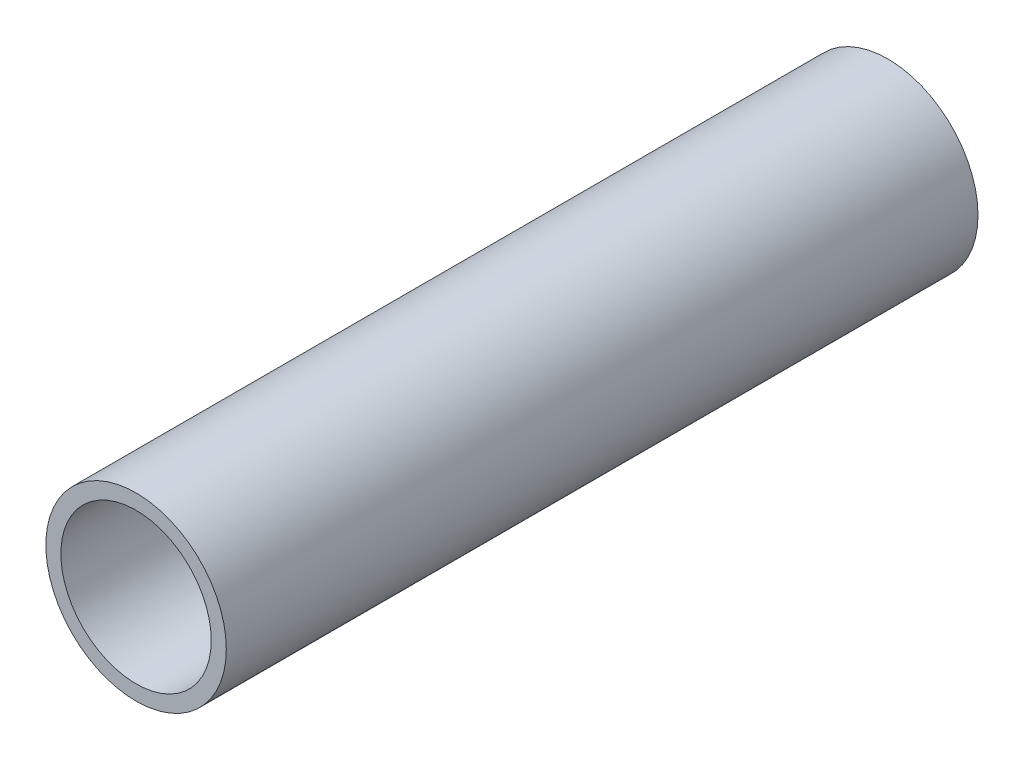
SolidWorks part; units mm, degrees
ref_plane "Plane1" through (0, 0, 0) normal (0, 0, 1) x (1, 0, 0)
ref_plane "Plane2" through (0, 0, 0) normal (0, 1, 0) x (1, 0, 0)
ref_plane "Plane3" through (0, 0, 0) normal (1, 0, 0) x (0, 0, -1)
sketch "Sketch1" plane through (0, 0, 0) normal (0, 0, 1) x (1, 0, 0)
  circle A0 centre (0, 0) radius 50
  dimension "D1" = 100
extrude "Base-Extrude-Thin" add sketch "Sketch1" along normal mid plane 499.9 thin
